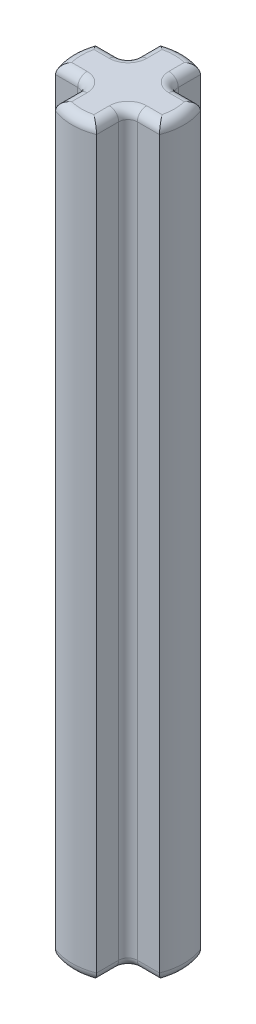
SolidWorks part; units mm, degrees
ref_plane "Front Plane" through (0, 0, 0) normal (0, 0, 1) x (1, 0, 0)
ref_plane "Top Plane" through (0, 0, 0) normal (0, 1, 0) x (1, 0, 0)
ref_plane "Right Plane" through (0, 0, 0) normal (1, 0, 0) x (0, 0, -1)
sketch "Sketch1" plane through (0, 0, 0) normal (0, 1, 0) x (1, 0, 0)
  line L8 (-2.2328, 0.88) -> (-0.88, 0.88)
  line L9 (2.2328, -0.88) -> (0.88, -0.88)
  line L10 (-0.88, 2.2328) -> (-0.88, 0.88)
  line L11 (-0.88, -0.88) -> (-0.88, -2.2328)
  line L12 (0.88, -2.2328) -> (0.88, -0.88)
  line L13 (0.88, 0.88) -> (2.2328, 0.88)
  line L14 (0.88, 0.88) -> (0.88, 2.2328)
  line L15 (-0.88, -0.88) -> (-2.2328, -0.88)
  arc A4 (2.2328, -0.88) -> (2.2328, 0.88) centre (0, 0) ccw
  arc A5 (0.88, 2.2328) -> (-0.88, 2.2328) centre (0, 0) ccw
  arc A6 (-2.2328, 0.88) -> (-2.2328, -0.88) centre (0, 0) ccw
  arc A7 (-0.88, -2.2328) -> (0.88, -2.2328) centre (0, 0) ccw
  dimension "D1" = 0.88
  dimension "D2" = 1.76
  dimension "D3" = 0.88
  dimension "D4" = 1.76
extrude "Boss-Extrude1" add sketch "Sketch1" along normal blind 32
fillet "Fillet7" radius 0.4 28 edges at (-1.5564, 0, -0.88) (-2.4, 0, 0) (-1.5564, 0, 0.88) (-0.88, 0, 1.5564) (0, 0, 2.4) (0.88, 0, 1.5564) (1.5564, 0, 0.88) (2.4, 0, 0) (1.5564, 0, -0.88) (0.88, 0, -1.5564) (0, 0, -2.4) (-0.88, 0, -1.5564) (0, 32, -2.4) (0.88, 32, -1.5564) (1.5564, 32, -0.88) (2.4, 32, 0) (1.5564, 32, 0.88) (0.88, 32, 1.5564) (0, 32, 2.4) (-0.88, 32, 1.5564) (-1.5564, 32, 0.88) (-2.4, 32, 0) (-1.5564, 32, -0.88) (-0.88, 32, -1.5564) (-0.88, 16, -0.88) (0.88, 16, 0.88) (-0.88, 16, 0.88) (0.88, 16, -0.88)
